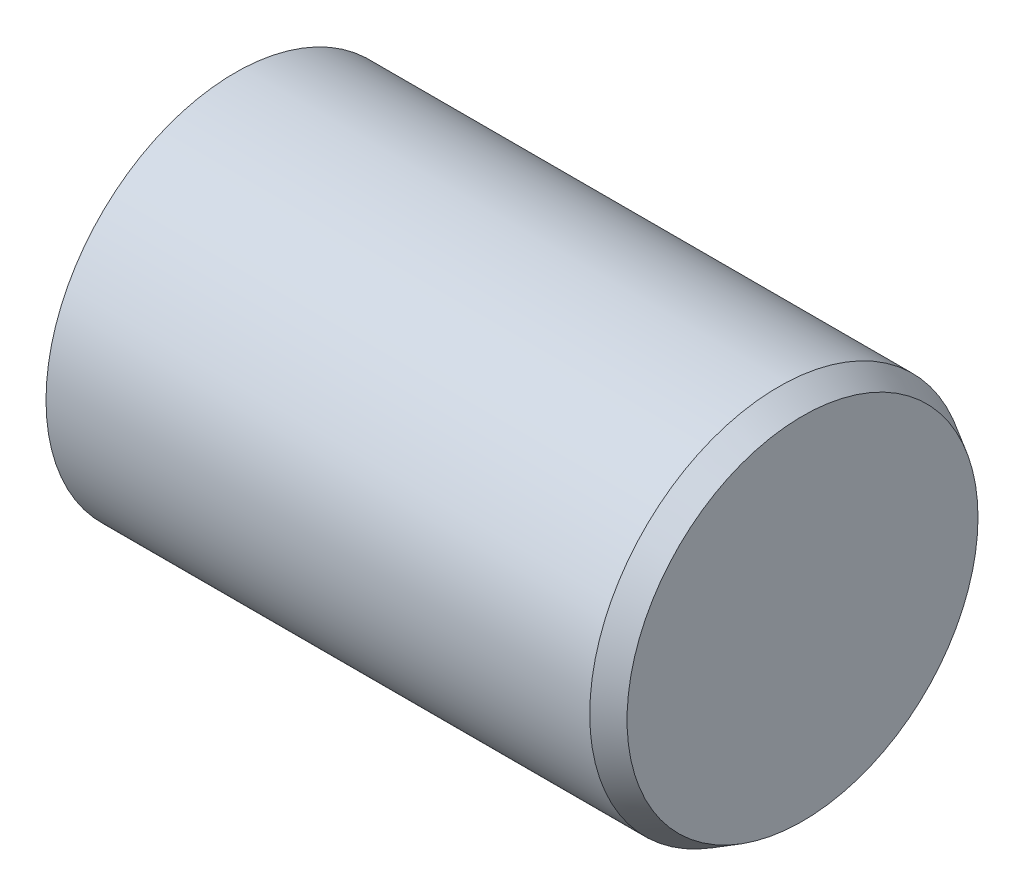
SolidWorks part; units mm, degrees
ref_plane "Plan de face" through (0, 0, 0) normal (0, 0, 1) x (1, 0, 0)
ref_plane "Plan de dessus" through (0, 0, 0) normal (0, 1, 0) x (1, 0, 0)
ref_plane "Plan de droite" through (0, 0, 0) normal (1, 0, 0) x (0, 0, -1)
sketch "Esquisse1" plane through (0, 0, 0) normal (1, 0, 0) x (0, 0, -1)
  circle A0 centre (0, 0) radius 4
extrude "Extrusion1" add sketch "Esquisse1" along normal blind 12
chamfer "Chanfrein1" distance 0.5 angle 30 1 edges at (12, 0, -4)
hole_wizard "Trou taraudé M4x0.71" positions "Esquisse3" profile "Esquisse2" tap size "M4x0.7" standard "ISO"
sketch "Esquisse3" plane through (0, 0, 0) normal (-1, 0, 0) x (0, 0, 1)
  point P0 (0, 0)
sketch "Esquisse2" plane through (0, 0, 0) normal (0, 1, 0) x (0, 0, 1)
  line L0 (0, 0) -> (0, 8.9526)
  line L1 (0, 8.9526) -> (1.65, 8)
  line L2 (1.65, 8) -> (1.65, 0)
  line L5 (1.65, 0) -> (0, 0)
  line L10 (0, 8.9526) -> (-1.65, 8) construction
  line L11 (0, -6.35) -> (0, 107.95) construction
  dimension "Diamètre du trou pour taraudage" = 3.3
  dimension "Profondeur du trou pour taraudage" = 8
  dimension "Angle de pointe" = 120
